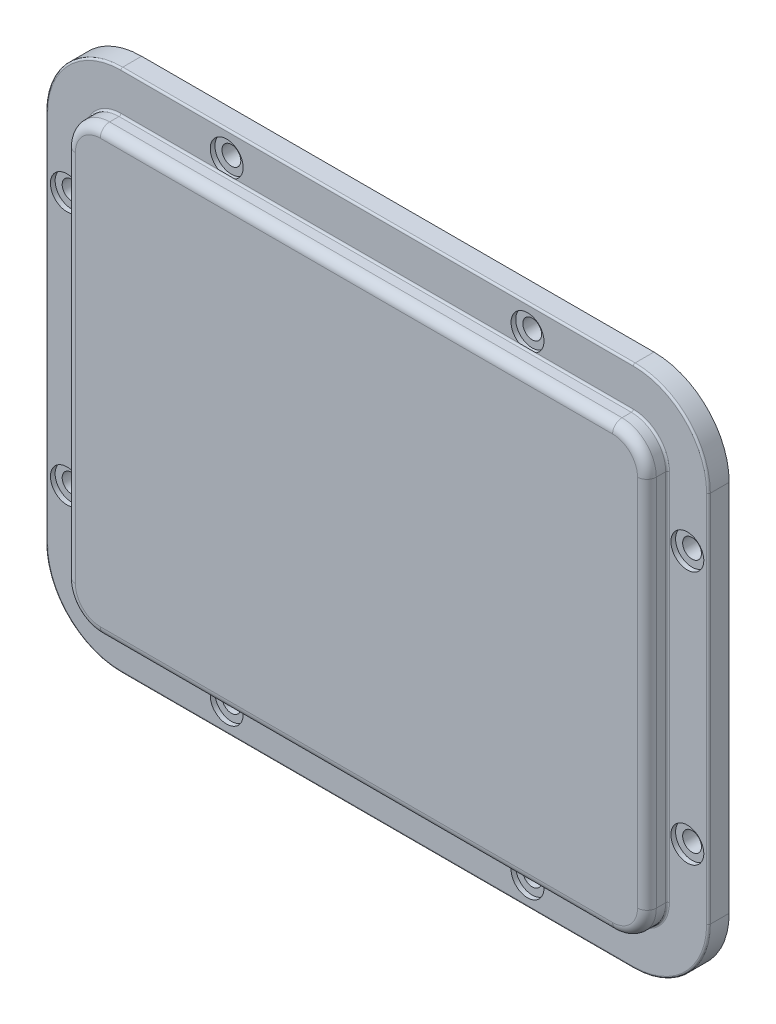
SolidWorks part; units mm, degrees
ref_plane "Plan de face" through (0, 0, 0) normal (0, 0, 1) x (1, 0, 0)
ref_plane "Plan de dessus" through (0, 0, 0) normal (0, 1, 0) x (1, 0, 0)
ref_plane "Plan de droite" through (0, 0, 0) normal (1, 0, 0) x (0, 0, -1)
sketch "Esquisse1" plane through (0, 0, 0) normal (0, 0, 1) x (1, 0, 0)
  line L1 (-35.25, 0) -> (0, 0)
  line L2 (-35.25, 0) -> (-35.25, 19.85)
  line L3 (-27.25, 27.85) -> (0, 27.85)
  line L4 (0, 0) -> (0, 27.85)
  arc A0 (-35.25, 19.85) -> (-27.25, 27.85) centre (-27.25, 19.85) cw
  point P7 (-35.25, 27.85)
  dimension "D3" = 8
  dimension "D1" = 35.25
  dimension "D2" = 27.85
extrude "Extrusion1" add sketch "Esquisse1" along normal blind 6.6
sketch "Esquisse2" plane through (0, 0, 6.6) normal (0, 0, 1) x (1, 0, 0)
  line L0 (-35.25, 0) -> (0, 0) construction
  line L1 (0, 0) -> (-30.9, 0)
  line L2 (0, 0) -> (0, 23.5)
  line L3 (0, 23.5) -> (-27.25, 23.5)
  line L4 (-30.9, 0) -> (-30.9, 19.85)
  arc A0 (-27.25, 23.5) -> (-30.9, 19.85) centre (-27.25, 19.85) ccw
  arc A1 (-27.25, 27.85) -> (-35.25, 19.85) centre (-27.25, 19.85) ccw construction
  dimension "D1" = 23.5
extrude "Enlèv. mat.-Extru.1" cut sketch "Esquisse2" against normal blind 2.2 flip side to cut
fillet "Congé2" radius 0.2 6 edges at (-30.9, 9.925, 4.4) (-29.8309, 22.4309, 4.4) (-35.25, 9.925, 4.4) (-32.9069, 25.5069, 4.4) (-13.625, 23.5, 4.4) (-13.625, 27.85, 4.4)
fillet "Congé3" radius 1 3 edges at (-30.9, 9.925, 6.6) (-29.8309, 22.4309, 6.6) (-13.625, 23.5, 6.6)
sketch "Esquisse3" plane through (0, 0, 0) normal (0, 0, -1) x (-1, 0, 0)
  line L1 (0, 0) -> (29.9, 0)
  line L2 (0, 0) -> (0, 22.6)
  line L3 (0, 22.6) -> (27.9, 22.6)
  line L4 (29.9, 0) -> (29.9, 20.6)
  arc A0 (27.9, 22.6) -> (29.9, 20.6) centre (27.9, 20.6) cw
  point P6 (29.9, 22.6)
  dimension "D3" = 2
  dimension "D1" = 29.9
  dimension "D2" = 22.6
extrude "Enlèv. mat.-Extru.2" cut sketch "Esquisse3" against normal blind 2.2 flip side to cut
sketch "Esquisse4" plane through (0, 0, 0) normal (0, 0, -1) x (-1, 0, 0)
  line L0 (27.9, 22.6) -> (0, 22.6) construction
  line L1 (-0.0375, 0) -> (28.7, 0)
  line L2 (-0.0375, 0) -> (-0.0375, 21.4)
  line L3 (-0.0375, 21.4) -> (27.9, 21.4)
  line L4 (28.7, 0) -> (28.7, 20.6)
  line L5 (29.9, 0) -> (29.9, 20.6) construction
  line L6 (29.9, 0) -> (0, 0) construction
  arc A0 (27.9, 21.4) -> (28.7, 20.6) centre (27.9, 20.6) cw
  dimension "D3" = 0.8
  dimension "D1" = 1.2
  dimension "D2" = 1.2
extrude "Enlèv. mat.-Extru.3" cut sketch "Esquisse4" against normal blind 5
fillet "Congé4" radius 0.5 3 edges at (-28.7, 10.3, 5) (-28.4657, 21.1657, 5) (-13.95, 21.4, 5)
sketch "Esquisse5" plane through (0, 0, 4.4) normal (0, 0, 1) x (1, 0, 0)
  line L0 (-29.9, 0) -> (0, 0) construction
  line L1 (0, 0) -> (0, 22.5) construction
  line L2 (0, 0) -> (0, 22.5) construction
  circle A0 centre (-16, 25.2) radius 1
  circle A1 centre (-33, 13.5) radius 1
  dimension "D3" = 2
  dimension "D1" = 25.2
  dimension "D2" = 16
  dimension "D4" = 13.5
  dimension "D5" = 33
extrude "Enlèv. mat.-Extru.4" cut sketch "Esquisse5" against normal up to next
sketch "Esquisse6" plane through (0, 0, 4.4) normal (0, 0, 1) x (1, 0, 0)
  circle A0 centre (-16, 25.2) radius 1.75
  circle A1 centre (-33, 13.5) radius 1.75
  circle A2 centre (-33, 13.5) radius 1 construction
  circle A3 centre (-16, 25.2) radius 1 construction
  dimension "D1" = 3.5
extrude "Enlèv. mat.-Extru.5" cut sketch "Esquisse6" against normal blind 0.5
mirror "Symétrie8" about plane through (0, 0, 6.6) normal (-1, 0, 0)
mirror "Symétrie9" about plane through (-35.25, 0, 6.6) normal (0, 1, 0)
